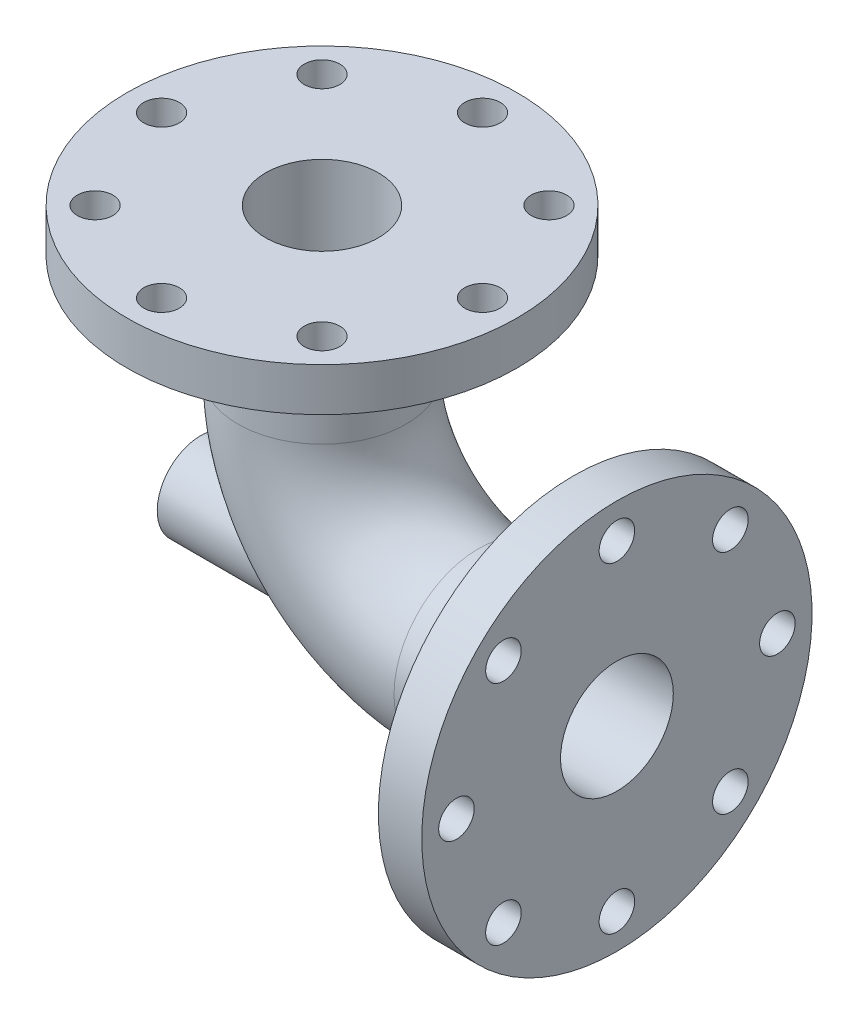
SolidWorks part; units mm, degrees
ref_plane "Front" through (0, 0, 0) normal (0, 0, 1) x (1, 0, 0)
ref_plane "Top" through (0, 0, 0) normal (0, 1, 0) x (1, 0, 0)
ref_plane "Right" through (0, 0, 0) normal (1, 0, 0) x (0, 0, -1)
sketch "Sketch1" plane through (0, 0, 0) normal (0, 0, 1) x (0, -1, 0)
  line L0 (0, -90) -> (-60, -90)
  line L1 (90, 0) -> (90, 55)
  arc A0 (90, 0) -> (0, -90) centre (0, 0) cw
  dimension "D1" = 90
  dimension "D2" = 55
  dimension "D3" = 60
ref_plane "Plane1" through (55, -90, 0) normal (1, 0, 0) x (0, 1, 0)
sketch "Sketch2" plane through (55, -90, 0) normal (1, 0, 0) x (0, 1, 0)
  circle A0 centre (0, 0) radius 48.5
  dimension "D1" = 97
sweep "Sweep-Thin1" add profiles "Sketch2" path "Sketch1" parameters "D1"=16
sketch "Sketch3" plane through (0, 60, 0) normal (0, 1, 0) x (-1, 0, 0)
  circle A0 centre (90, 0) radius 112.5
  circle A1 centre (90, 0) radius 48.5 construction
  circle A2 centre (90, 0) radius 32.5 construction
  circle A3 centre (90, 0) radius 32.5
  dimension "D1" = 225
extrude "Extrude1" add sketch "Sketch3" along normal blind 25
sketch "Sketch4" plane through (55, -120.7585, 119.1706) normal (1, 0, 0) x (0, 0, -1)
  circle A0 centre (119.1706, 30.7585) radius 112.5
  circle A3 centre (119.1706, 30.7585) radius 32.5
  circle A4 centre (119.1706, 30.7585) radius 32.5 construction
  dimension "D1" = 225
extrude "Extrude2" add sketch "Sketch4" along normal blind 25
ref_plane "Plane2" through (-160, 0, 0) normal (-1, 0, 0) x (0, 0, 1)
sketch "Sketch5" plane through (-160, 0, 0) normal (-1, 0, 0) x (0, 0, 1)
  circle A0 centre (0, -90) radius 25
  circle A1 centre (0, -90) radius 112.5 construction
  dimension "D2" = 50
extrude "Extrude3" add sketch "Sketch5" against normal up to next
sketch "Sketch6" plane through (0, 85, 0) normal (0, 1, 0) x (-1, 0, 0)
  circle A0 centre (90, 0) radius 32.5 construction
  point P0 (182.5, 0)
  dimension "D1" = 92.5
other "Hole1" parameters "D1"=25
sketch "Sketch11" plane through (0, 85, 0) normal (0, 1, 0) x (-1, 0, 0)
  circle A0 centre (182.5, 0) radius 10.25
  dimension "D1" = 20.5
sketch "Sketch12" plane through (80, -54.0847, 232.9229) normal (1, 0, 0) x (0, 0, -1)
  circle A0 centre (232.9229, 56.5847) radius 10.25
  circle A1 centre (232.9229, -35.9153) radius 32.5 construction
  dimension "D1" = 20.5
  dimension "D2" = 92.5
other "Hole2" parameters "D1"=25
pattern_circular "CirPattern1" count 8 over 360
pattern_circular "CirPattern2" count 8 over 360
sketch "Sketch13" plane through (0, 0, 0) normal (0, 0, 1) x (1, 0, 0)
  line L0 (-172.2091, -90) -> (-80.8961, -90) construction
  line L1 (-98.7004, -90) -> (-160, -90) construction
  line L2 (-160, -90) -> (-160, -78)
  line L3 (-160, -65) -> (-160, -115) construction
  line L4 (-160, -78) -> (-132, -78)
  line L5 (-132, -78) -> (-132, -80)
  line L6 (-132, -80) -> (-41.6039, -80)
  line L7 (-41.6039, -80) -> (-41.6039, -90)
  line L8 (-41.6039, -90) -> (-160, -90)
  dimension "D1" = 28
  dimension "D2" = 24
  dimension "D3" = 20
revolve "Cut-Revolve1" cut sketch "Sketch13" angle 360 about L0
